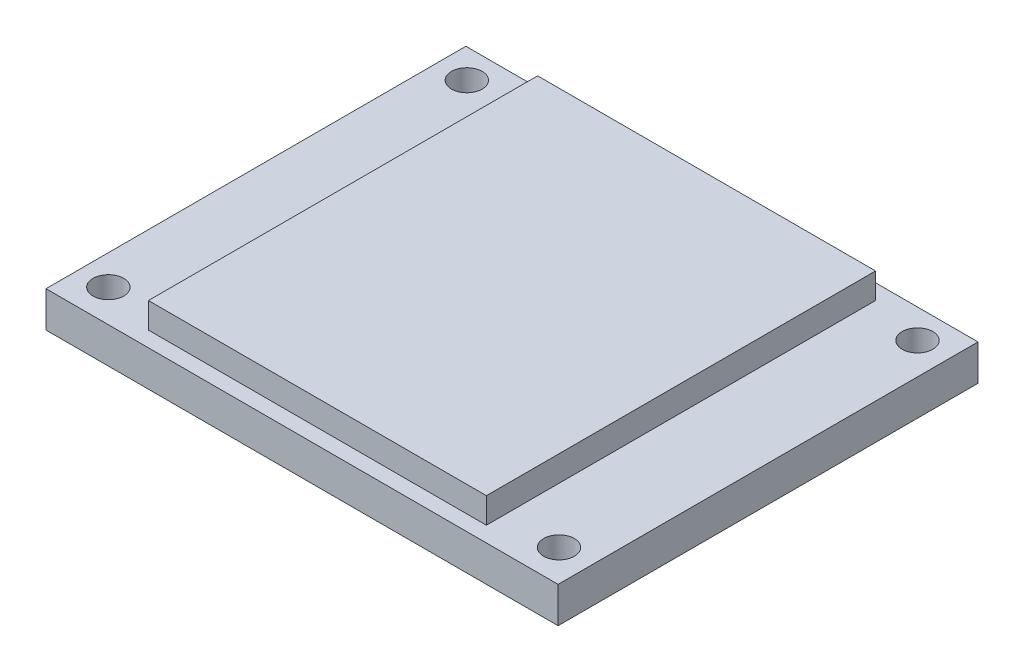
SolidWorks part; units mm, degrees
ref_plane "Front Plane" through (0, 0, 0) normal (0, 0, 1) x (1, 0, 0)
ref_plane "Top Plane" through (0, 0, 0) normal (0, 1, 0) x (1, 0, 0)
ref_plane "Right Plane" through (0, 0, 0) normal (1, 0, 0) x (0, 0, -1)
sketch "Sketch1" plane through (0, 0, 0) normal (0, 1, 0) x (1, 0, 0)
  line L1 (-22.5806, 14.0323) -> (27.4194, 14.0323)
  line L2 (-22.5806, 14.0323) -> (-22.5806, -26.9677)
  line L3 (-22.5806, -26.9677) -> (27.4194, -26.9677)
  line L4 (27.4194, 14.0323) -> (27.4194, -26.9677)
  dimension "D1" = 50
  dimension "D2" = 41
extrude "Boss-Extrude1" add sketch "Sketch1" along normal blind 3.5
sketch "Sketch2" plane through (0, 3.5, 0) normal (0, 1, 0) x (1, 0, 0)
  circle A0 centre (-19.6624, 11.2034) radius 1.5
  circle A1 centre (-19.6624, -23.7966) radius 1.5
  circle A2 centre (24.3376, -23.7967) radius 1.5
  circle A3 centre (24.3376, 11.2033) radius 1.5
  point P6 (0, 0)
  point P9 (0, 0)
  point P10 (-8.8949, 9.1367)
  point P11 (0, 0)
  point P12 (0, 0)
  point P13 (23.744, 11.2033)
  point P14 (24.3376, 11.2033)
  point P15 (-19.6624, -23.7967)
  dimension "D1" = 3
  dimension "D3" = 44
  dimension "D4" = 35
  dimension "D2" = 35
  dimension "D5" = 44
extrude "Cut-Extrude1" cut sketch "Sketch2" against normal blind 3.5
sketch "Sketch3" plane through (0, 3.5, 0) normal (0, 1, 0) x (1, 0, 0)
  line L0 (-22.5806, -26.9677) -> (27.4194, -26.9677) construction
  line L1 (-14.0806, 12.5323) -> (18.9194, 12.5323)
  line L2 (-14.0806, 12.5323) -> (-14.0806, -25.4677)
  line L3 (-14.0806, -25.4677) -> (18.9194, -25.4677)
  line L4 (18.9194, 12.5323) -> (18.9194, -25.4677)
  line L6 (27.4194, -26.9677) -> (27.4194, 14.0323) construction
  dimension "D1" = 33
  dimension "D2" = 38
  dimension "D3" = 1.5
  dimension "D4" = 8.5
extrude "Boss-Extrude2" add sketch "Sketch3" along normal blind 2.5
